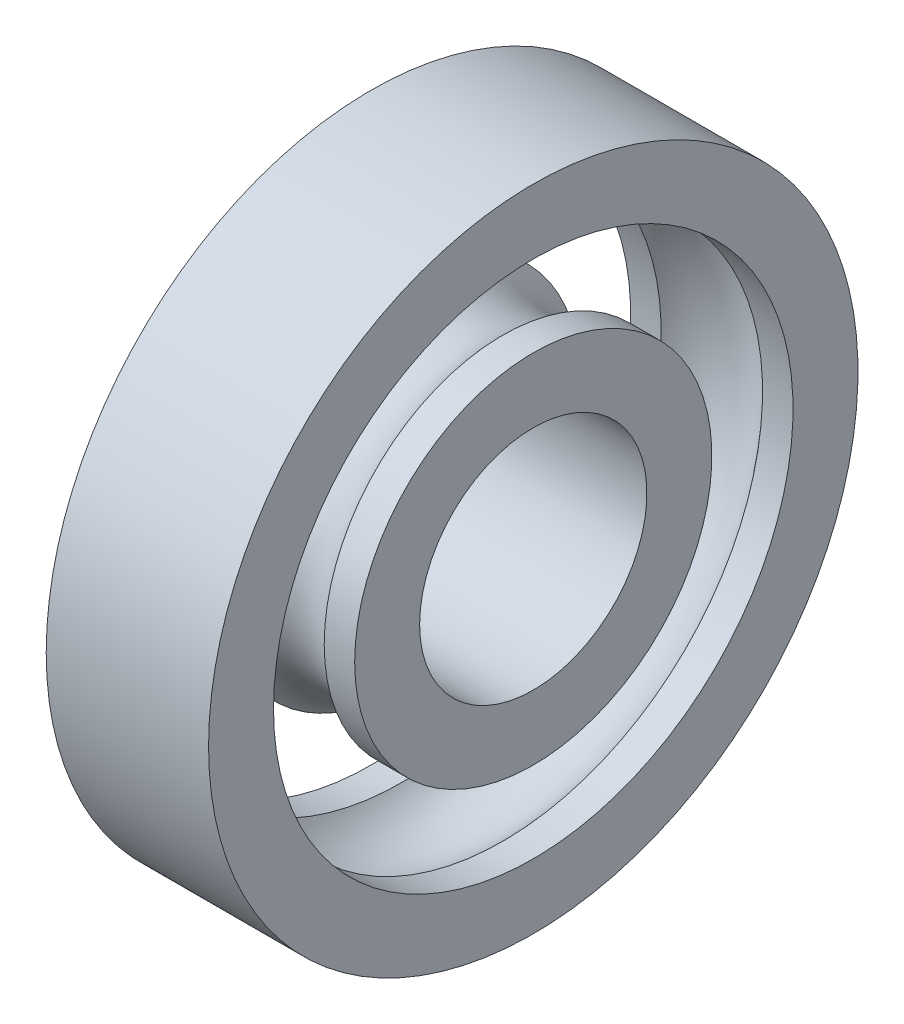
SolidWorks part; units mm, degrees
ref_plane "Front Plane" through (0, 0, 0) normal (0, 0, 1) x (1, 0, 0)
ref_plane "Top Plane" through (0, 0, 0) normal (0, 1, 0) x (1, 0, 0)
ref_plane "Right Plane" through (0, 0, 0) normal (1, 0, 0) x (0, 0, -1)
sketch "Sketch1" plane through (0, 0, 0) normal (0, 0, 1) x (1, 0, 0)
  line L0 (-3.1225, 16) -> (-5, 16)
  line L1 (5, 16) -> (3.1225, 16)
  line L2 (5, 16) -> (5, 20)
  line L3 (5, 20) -> (-5, 20)
  line L4 (-5, 16) -> (-5, 20)
  line L5 (5, 16) -> (-5, 20) construction
  line L6 (5, 20) -> (-5, 16) construction
  line L7 (5, 7) -> (-5, 7)
  line L8 (5, 7) -> (5, 11)
  line L9 (5, 11) -> (3.1225, 11)
  line L10 (-5, 7) -> (-5, 11)
  line L11 (5, 7) -> (-5, 11) construction
  line L12 (5, 11) -> (-5, 7) construction
  line L13 (-3.1225, 11) -> (-5, 11)
  arc A0 (3.1225, 16) -> (-3.1225, 16) centre (0, 13.5) ccw
  arc A1 (-3.1225, 11) -> (3.1225, 11) centre (0, 13.5) ccw
  point P0 (0, 18)
  point P6 (0, 9)
  point P13 (0, 0)
  dimension "D5" = 13.5
  dimension "D6" = 8
  dimension "D1" = 7
  dimension "D2" = 20
  dimension "D3" = 4
  dimension "D4" = 4
  dimension "D7" = 10
  dimension "D8" = 10
sketch "Sketch3" plane through (0, 0, 0) normal (0, 1, 0) x (1, 0, 0)
  line L0 (-5.5399, 0) -> (6.3906, 0) construction
revolve "Revolve1" add sketch "Sketch1" angle 360 about L0
